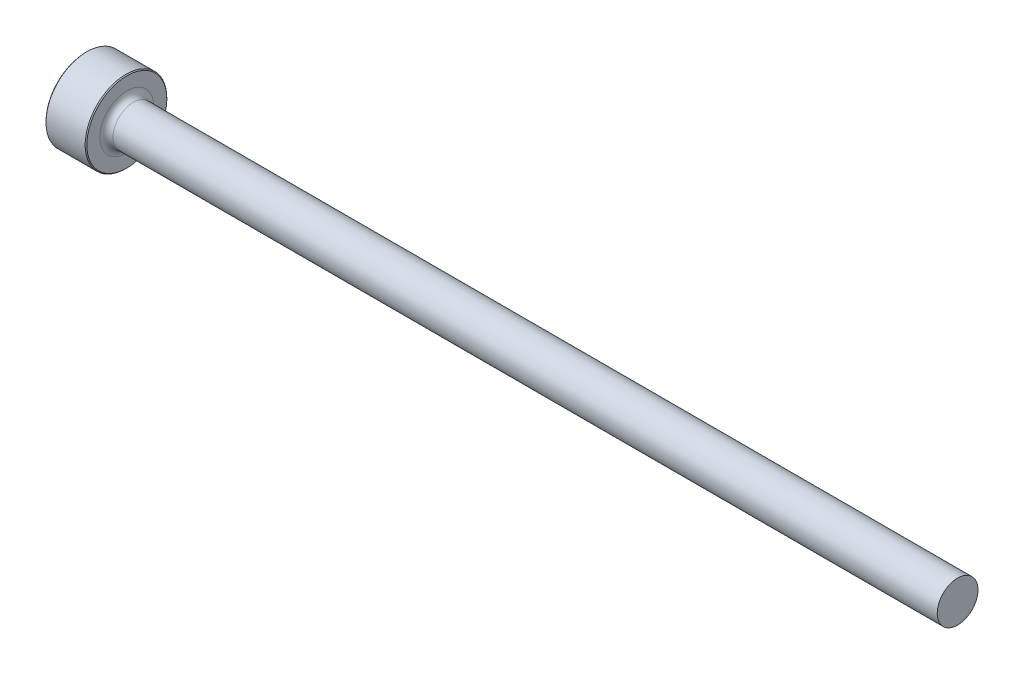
SolidWorks part; units mm, degrees
ref_plane "Front Plane" through (0, 0, 0) normal (0, 0, 1) x (1, 0, 0)
ref_plane "Top Plane" through (0, 0, 0) normal (0, 1, 0) x (1, 0, 0)
ref_plane "Right Plane" through (0, 0, 0) normal (1, 0, 0) x (0, 0, -1)
sketch "Sketch1" plane through (0, 0, 0) normal (0, 0, 1) x (1, 0, 0)
  line L0 (0, 0) -> (0, 4.7625)
  line L1 (0, 4.7625) -> (4.7625, 4.7625)
  line L2 (4.7625, 4.7625) -> (4.7625, 3.1394)
  line L3 (5.5245, 2.3774) -> (101.6, 2.3774)
  line L4 (101.6, 2.3774) -> (101.6, 0)
  line L5 (101.6, 0) -> (0, 0)
  line L6 (101.6, 0) -> (101.6, -2.3774) construction
  line L7 (101.6, -2.3774) -> (4.7625, -2.3774) construction
  line L8 (0, 0) -> (0, -4.7625) construction
  line L9 (0, -4.7625) -> (4.7625, -4.7625) construction
  line L10 (4.7625, -4.7625) -> (4.7625, -2.3774) construction
  arc A0 (4.7625, 3.1394) -> (5.5245, 2.3774) centre (5.5245, 3.1394) ccw
  dimension "D4" = 0.762
  dimension "L" = 101.6
  dimension "D" = 4.7549
  dimension "H" = 9.525
  dimension "T" = 4.7625
revolve "Revolve1" add sketch "Sketch1" angle 360 about L5
chamfer "Chamfer1" distance 0.1016 angle 45 2 edges at (0, 4.7625, 0) (4.7625, 4.7625, 0)
